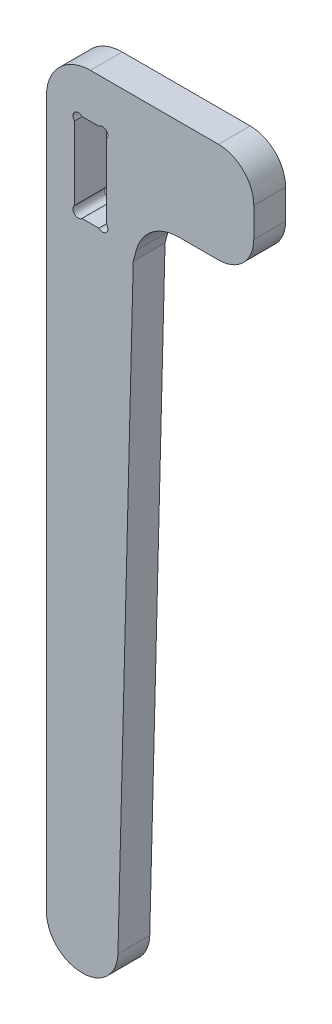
SolidWorks part; units mm, degrees
ref_plane "Plan de face" through (0, 0, 0) normal (0, 0, 1) x (1, 0, 0)
ref_plane "Plan de dessus" through (0, 0, 0) normal (0, 1, 0) x (1, 0, 0)
ref_plane "Plan de droite" through (0, 0, 0) normal (1, 0, 0) x (0, 0, -1)
sketch "Esquisse1" plane through (0, 0, 0) normal (0, 0, 1) x (1, 0, 0)
  line L0 (74.9, -6.7542) -> (117.393, -6.7542)
  line L3 (24.9, 50) -> (117.393, 50)
  line L7 (24.9, -50) -> (25.1, -50)
  line L9 (0, 25.1) -> (0, -394.9)
  line L21 (49.1521, -31.5426) -> (50.8479, -25.2116)
  line L23 (0, 25.1) -> (0, -394.9)
  line L24 (0, -394.9) -> (40, -394.9)
  line L25 (49.1521, -31.5426) -> (40, -394.9)
  line L26 (117.393, 50) -> (117.393, -6.7542)
  arc A3 (74.9, -6.7542) -> (50.8479, -25.2116) centre (74.9, -31.6542) ccw
  arc A6 (0, 25.1) -> (24.9, 50) centre (24.9, 25.1) cw
  point P21 (50, -50)
  dimension "D9" = 24.9
  dimension "D2" = 420
  dimension "D4" = 40
extrude "Boss.-Extru.1" add sketch "Esquisse1" along normal blind 18
fillet "Congé1" radius 20 2 edges at (117.393, -6.7542, 9) (117.393, 50, 9)
fillet "Congé2" radius 20 2 edges at (0, -394.9, 9) (40, -394.9, 9)
sketch "Esquisse2" plane through (0, 0, 18) normal (0, 0, 1) x (1, 0, 0)
  line L0 (24.9, 50) -> (24.9, 0) construction
  line L2 (15.9, -25) -> (33.9, -25)
  line L3 (15.9, -25) -> (15.9, 25)
  line L4 (15.9, 25) -> (33.9, 25)
  line L5 (33.9, -25) -> (33.9, 25)
  line L6 (15.9, -25) -> (33.9, 25) construction
  line L7 (15.9, 25) -> (33.9, -25) construction
  dimension "D1" = 50
  dimension "D2" = 18
  dimension "D3" = 50
extrude "Enlèv. mat.-Extru.1" cut sketch "Esquisse2" against normal through all
sketch "Esquisse3" plane through (0, 0, 18) normal (0, 0, 1) x (1, 0, 0)
  line L0 (18.0213, 22.8787) -> (18.0213, 25) construction
  line L1 (33.9, 25) -> (15.9, 25) construction
  line L2 (18.0213, 22.8787) -> (15.9, 22.8787) construction
  line L3 (15.9, 25) -> (15.9, -25) construction
  line L4 (24.9, 25) -> (24.9, -25) construction
  line L5 (15.9, -25) -> (33.9, -25) construction
  line L6 (15.9, 0) -> (33.9, 0) construction
  line L7 (33.9, -25) -> (33.9, 25) construction
  circle A0 centre (18.0213, 22.8787) radius 3
  circle A1 centre (31.7787, -22.8787) radius 3
  circle A2 centre (31.7787, 22.8787) radius 3
  circle A3 centre (18.0213, -22.8787) radius 3
  point P17 (24.9, 0)
  point P22 (24.9, 0)
  dimension "D1" = 6
  dimension "D2" = 2
extrude "Enlèv. mat.-Extru.2" cut sketch "Esquisse3" against normal through all
